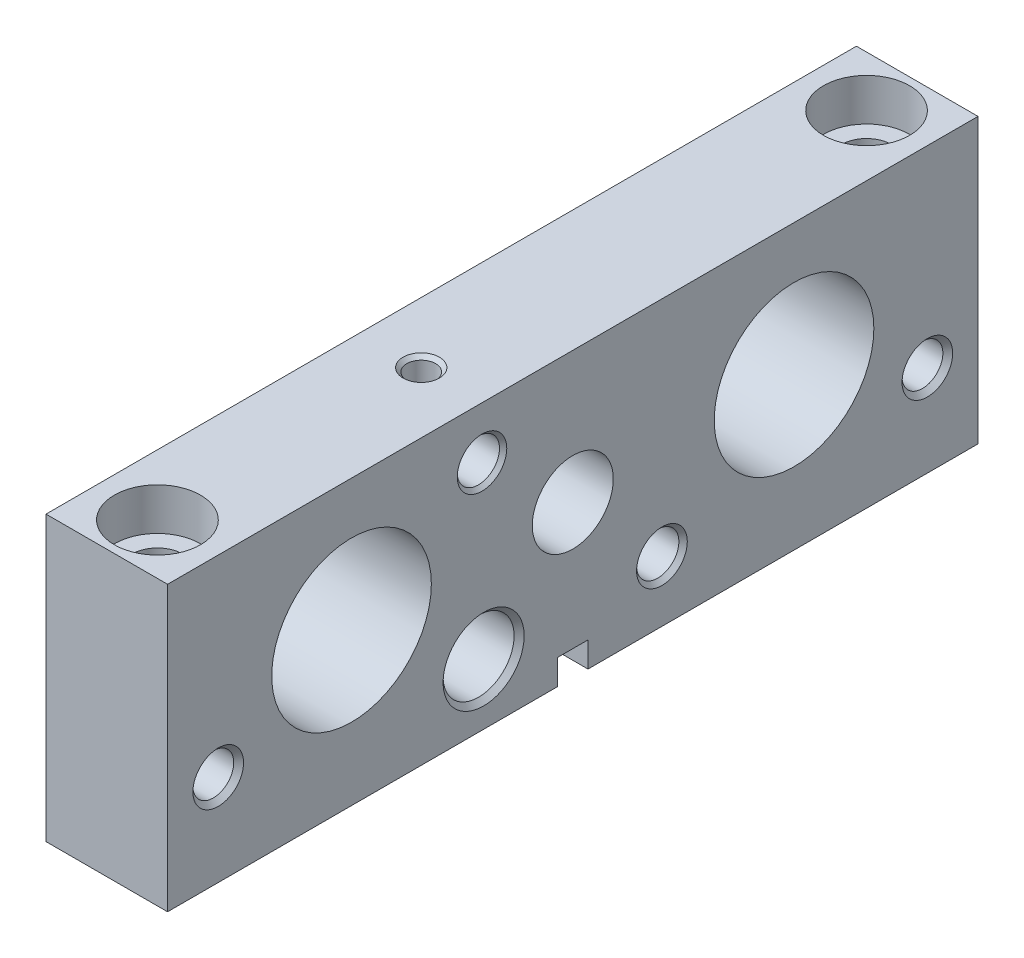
SolidWorks part; units mm, degrees
ref_plane "Front Plane" through (0, 0, 0) normal (0, 0, 1) x (1, 0, 0)
ref_plane "Top Plane" through (0, 0, 0) normal (0, 1, 0) x (1, 0, 0)
ref_plane "Right Plane" through (0, 0, 0) normal (1, 0, 0) x (0, 0, -1)
sketch "Sketch1" plane through (0, 0, 0) normal (1, 0, 0) x (0, 0, -1)
  line L0 (-63.5, -23.8252) -> (-2.3838, -23.8252)
  line L1 (-2.3838, -23.8252) -> (-2.3838, -19.8628)
  line L2 (-2.3838, -19.8628) -> (2.3838, -19.8628)
  line L3 (2.3838, -19.8628) -> (2.3838, -23.8252)
  line L4 (2.3838, -23.8252) -> (63.5, -23.8252)
  line L5 (63.5, -23.8252) -> (63.5, 20.6248)
  line L6 (63.5, 20.6248) -> (-63.5, 20.6248)
  line L7 (-63.5, 20.6248) -> (-63.5, -23.8252)
extrude "Extrude1" add sketch "Sketch1" along normal blind 19.05
ref_plane "Plane1" through (0, -23.8252, 0) normal (0, 1, 0) x (-1, 0, 0)
ref_plane "Plane2" through (0, -19.8628, 0) normal (0, 1, 0) x (-1, 0, 0)
sketch "Sketch2" plane through (0, -19.8628, 0) normal (0, 1, 0) x (-1, 0, 0)
  circle A0 centre (-9.525, 0) radius 2.3838
extrude "Cut-Extrude1" cut sketch "Sketch2" along normal blind 6.35
ref_plane "Plane3" through (0, -14.3002, 0) normal (0, 1, 0) x (-1, 0, 0)
sketch "Sketch3" plane through (0, -14.3002, 0) normal (0, 1, 0) x (-1, 0, 0)
  line L0 (-19.05, -13.97) -> (-19.05, -9.9949)
  line L1 (-19.05, -9.9949) -> (-18.3896, -10.6553)
  line L2 (-18.3896, -10.6553) -> (-0.6604, -10.6553)
  line L3 (-0.6604, -10.6553) -> (0, -9.9949)
  line L4 (0, -9.9949) -> (0, -13.97)
  line L5 (0, -13.97) -> (-19.05, -13.97)
  line L6 (0, -13.97) -> (-19.05, -13.97) construction
revolve "Cut-Revolve1" cut sketch "Sketch3" angle 360 about L6
ref_plane "Plane4" through (0, -14.3002, 0) normal (0, 1, 0) x (-1, 0, 0)
sketch "Sketch4" plane through (0, -14.3002, 0) normal (0, 1, 0) x (-1, 0, 0)
  line L0 (-19.05, 13.97) -> (-19.05, 20.32)
  line L1 (-19.05, 20.32) -> (-18.2626, 19.5326)
  line L2 (-18.2626, 19.5326) -> (-0.7874, 19.5326)
  line L3 (-0.7874, 19.5326) -> (0, 20.32)
  line L4 (0, 20.32) -> (0, 13.97)
  line L5 (0, 13.97) -> (-19.05, 13.97)
  line L6 (0, 13.97) -> (-19.05, 13.97) construction
revolve "Cut-Revolve2" cut sketch "Sketch4" angle 360 about L6
ref_plane "Plane5" through (0, 12.4968, 0) normal (0, 1, 0) x (-1, 0, 0)
sketch "Sketch5" plane through (0, 12.4968, 0) normal (0, 1, 0) x (-1, 0, 0)
  line L0 (-19.05, 14.224) -> (-19.05, 18.104)
  line L1 (-19.05, 18.104) -> (-18.4795, 17.5335)
  line L2 (-18.4795, 17.5335) -> (-0.5705, 17.5335)
  line L3 (-0.5705, 17.5335) -> (0, 18.104)
  line L4 (0, 18.104) -> (0, 14.224)
  line L5 (0, 14.224) -> (-19.05, 14.224)
  line L6 (0, 14.224) -> (-19.05, 14.224) construction
revolve "Cut-Revolve3" cut sketch "Sketch5" angle 360 about L6
ref_plane "Plane6" through (0, 0, 55.5625) normal (0, 0, 1) x (1, 0, 0)
ref_plane "Plane7" through (0, 0, -55.5625) normal (0, 0, 1) x (1, 0, 0)
sketch "Sketch6" plane through (0, 0, -55.5625) normal (0, 0, 1) x (1, 0, 0)
  line L0 (9.525, 20.6248) -> (16.2725, 20.6248)
  line L1 (16.2725, 20.6248) -> (16.2725, 14.0208)
  line L2 (16.2725, 14.0208) -> (13.4938, 14.0208)
  line L3 (13.4938, 14.0208) -> (13.4938, -23.8252)
  line L4 (13.4938, -23.8252) -> (9.525, -23.8252)
  line L5 (9.525, -23.8252) -> (9.525, 20.6248)
  line L6 (9.525, -23.8252) -> (9.525, 20.6248) construction
revolve "Cut-Revolve4" cut sketch "Sketch6" angle 360 about L6
sketch "Sketch7" plane through (0, 0, 55.5625) normal (0, 0, 1) x (1, 0, 0)
  line L0 (9.525, 20.6248) -> (16.2725, 20.6248)
  line L1 (16.2725, 20.6248) -> (16.2725, 14.0208)
  line L2 (16.2725, 14.0208) -> (13.4938, 14.0208)
  line L3 (13.4938, 14.0208) -> (13.4938, -23.8252)
  line L4 (13.4938, -23.8252) -> (9.525, -23.8252)
  line L5 (9.525, -23.8252) -> (9.525, 20.6248)
  line L6 (9.525, -23.8252) -> (9.525, 20.6248) construction
revolve "Cut-Revolve5" cut sketch "Sketch7" angle 360 about L6
ref_plane "Plane8" through (0, 0, -31.75) normal (0, 0, 1) x (1, 0, 0)
ref_plane "Plane9" through (0, 0, -25.4) normal (0, 0, 1) x (1, 0, 0)
ref_plane "Plane10" through (0, 0, 13.97) normal (0, 0, 1) x (1, 0, 0)
ref_plane "Plane11" through (0, 0, 13.4874) normal (0, 0, 1) x (1, 0, 0)
ref_plane "Plane12" through (0, 0, 14.224) normal (0, 0, 1) x (1, 0, 0)
sketch "Sketch8" plane through (0, 0, 14.224) normal (0, 0, 1) x (1, 0, 0)
  line L0 (9.525, 20.6248) -> (12.3698, 20.6248)
  line L1 (12.3698, 20.6248) -> (11.7856, 20.0406)
  line L2 (11.7856, 20.0406) -> (11.7856, 16.256)
  line L3 (11.7856, 16.256) -> (9.525, 14.9508)
  line L4 (9.525, 14.9508) -> (9.525, 20.6248)
  line L5 (9.525, 14.9508) -> (9.525, 20.6248) construction
revolve "Cut-Revolve6" cut sketch "Sketch8" angle 360 about L5
ref_plane "Plane13" through (0, 0, 0) normal (1, 0, 0) x (0, 0, -1)
ref_plane "Plane14" through (9.525, 0, 0) normal (1, 0, 0) x (0, 0, -1)
ref_plane "Plane15" through (0, 0, 0) normal (0, 1, 0) x (-1, 0, 0)
sketch "Sketch9" plane through (0, 0, 0) normal (0, 1, 0) x (-1, 0, 0)
  line L0 (-19.05, 34.671) -> (-19.05, 47.1805)
  line L1 (-19.05, 47.1805) -> (0, 47.1805)
  line L2 (0, 47.1805) -> (0, 34.671)
  line L3 (0, 34.671) -> (-19.05, 34.671)
  line L4 (0, 34.671) -> (-19.05, 34.671) construction
sketch "Sketch10" plane through (0, 0, 0) normal (0, 1, 0) x (-1, 0, 0)
  line L0 (-19.05, -34.671) -> (-19.05, -22.1615)
  line L1 (-19.05, -22.1615) -> (0, -22.1615)
  line L2 (0, -22.1615) -> (0, -34.671)
  line L3 (0, -34.671) -> (-19.05, -34.671)
  line L4 (0, -34.671) -> (-19.05, -34.671) construction
revolve "Cut-Revolve7" cut sketch "Sketch9" angle 360 about L4
revolve "Cut-Revolve8" cut sketch "Sketch10" angle 360 about L4
sketch "Sketch11" plane through (0, 0, 0) normal (0, 1, 0) x (-1, 0, 0)
  line L0 (0, 0) -> (0, -5.1318)
  line L1 (0, -5.1318) -> (-0.6004, -4.5313)
  line L2 (-0.6004, -4.5313) -> (-9.525, -4.2524)
  line L3 (-9.525, -4.2524) -> (-9.525, -6.35)
  line L4 (-9.525, -6.35) -> (-19.05, -6.35)
  line L5 (-19.05, -6.35) -> (-19.05, 0)
  line L6 (-19.05, 0) -> (0, 0)
  line L7 (-19.05, 0) -> (0, 0) construction
revolve "Cut-Revolve9" cut sketch "Sketch11" angle 360 about L7
ref_plane "Plane16" through (19.05, 0, 0) normal (1, 0, 0) x (0, 0, -1)
ref_plane "Plane17" through (0, 0, 0) normal (1, 0, 0) x (0, 0, -1)
ref_plane "Plane18" through (0, -9.525, 0) normal (0, 1, 0) x (-1, 0, 0)
sketch "Sketch12" plane through (0, -9.525, 0) normal (0, 1, 0) x (-1, 0, 0)
  line L0 (-19.05, 55.5625) -> (-19.05, 59.5312)
  line L1 (-19.05, 59.5312) -> (-18.2816, 58.7629)
  line L2 (-18.2816, 58.7629) -> (-0.7683, 58.7629)
  line L3 (-0.7683, 58.7629) -> (0, 59.5312)
  line L4 (0, 59.5312) -> (0, 55.5625)
  line L5 (0, 55.5625) -> (-19.05, 55.5625)
  line L6 (0, 55.5625) -> (-19.05, 55.5625) construction
sketch "Sketch13" plane through (0, -9.525, 0) normal (0, 1, 0) x (-1, 0, 0)
  line L0 (-19.05, -55.5625) -> (-19.05, -51.5938)
  line L1 (-19.05, -51.5938) -> (-18.2816, -52.3621)
  line L2 (-18.2816, -52.3621) -> (-0.7683, -52.3621)
  line L3 (-0.7683, -52.3621) -> (0, -51.5938)
  line L4 (0, -51.5938) -> (0, -55.5625)
  line L5 (0, -55.5625) -> (-19.05, -55.5625)
  line L6 (0, -55.5625) -> (-19.05, -55.5625) construction
revolve "Cut-Revolve10" cut sketch "Sketch13" angle 360 about L6
revolve "Cut-Revolve11" cut sketch "Sketch12" angle 360 about L6
